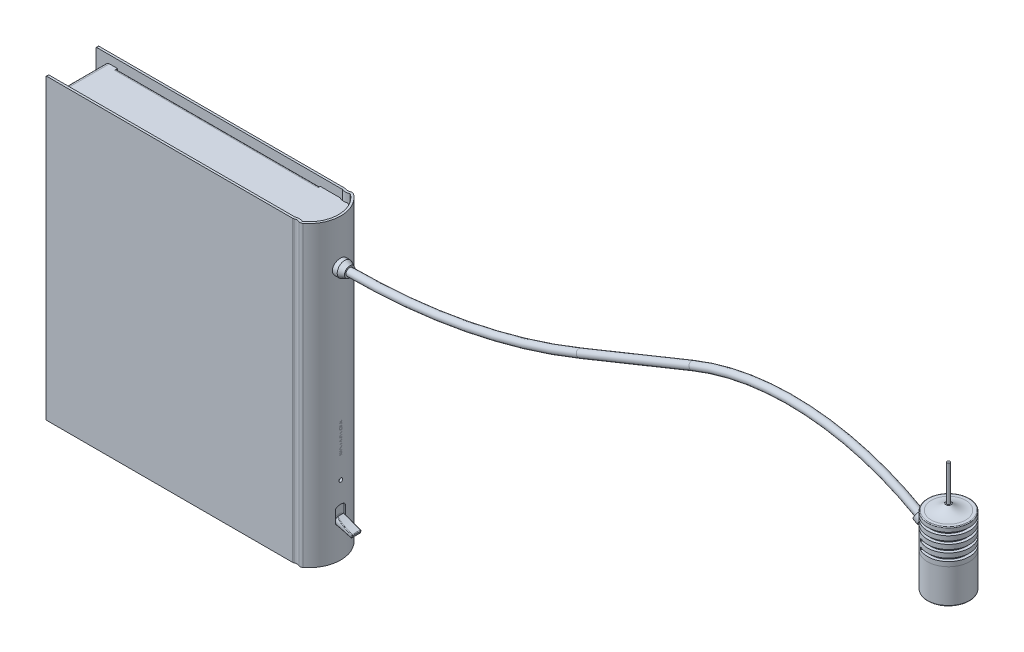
SolidWorks part; units mm, degrees
ref_plane "Alzado" through (0, 0, 0) normal (0, 0, 1) x (1, 0, 0)
ref_plane "Planta" through (0, 0, 0) normal (0, 1, 0) x (1, 0, 0)
ref_plane "Vista lateral" through (0, 0, 0) normal (1, 0, 0) x (0, 0, -1)
imported_body "Simplificado37"
imported_body "Simplificado38"
imported_body "Simplificado39"
imported_body "Simplificado40"
imported_body "Simplificado41"
imported_body "Simplificado42"
imported_body "Simplificado43"
imported_body "Simplificado44"
imported_body "Simplificado45"
imported_body "Simplificado46"
combine bodies "Combinar1" operation type add bodies to combine 282 290 289 288 287 286 285 284 283
